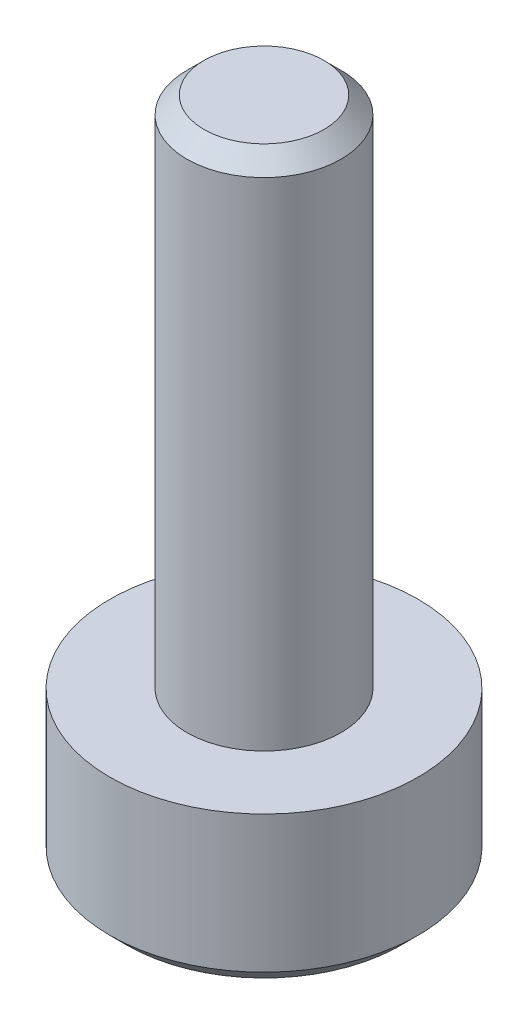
SolidWorks part; units mm, degrees
ref_plane "Front Plane" through (0, 0, 0) normal (0, 0, 1) x (1, 0, 0)
ref_plane "Top Plane" through (0, 0, 0) normal (0, 1, 0) x (1, 0, 0)
ref_plane "Right Plane" through (0, 0, 0) normal (1, 0, 0) x (0, 0, -1)
sketch "Sketch1" plane through (0, 0, 0) normal (0, 1, 0) x (1, 0, 0)
  circle A0 centre (0, 0) radius 1.5
  dimension "D1" = 3
extrude "Boss-Extrude1" add sketch "Sketch1" along normal blind 10
sketch "Sketch2" plane through (0, 0, 0) normal (0, -1, 0) x (1, 0, 0)
  circle A0 centre (0, 0) radius 3
  circle A1 centre (0, 0) radius 1.5 construction
extrude "Boss-Extrude2" add sketch "Sketch2" along normal blind 3 contours A0
sketch "Sketch3" plane through (0, -3, 0) normal (0, -1, 0) x (1, 0, 0)
  line L1 (0, 1.7321) -> (-1.5, 0.866)
  line L2 (-1.5, 0.866) -> (-1.5, -0.866)
  line L3 (-1.5, -0.866) -> (0, -1.7321)
  line L4 (0, -1.7321) -> (1.5, -0.866)
  line L5 (1.5, -0.866) -> (1.5, 0.866)
  line L6 (1.5, 0.866) -> (0, 1.7321)
  circle A0 centre (0, 0) radius 1.5 construction
extrude "Cut-Extrude1" cut sketch "Sketch3" against normal blind 2
chamfer "Chamfer1" distance 0.3333 angle 45 2 edges at (0, 10, 1.5) (0, -3, -3)
equation "\"Length\"= 10"
equation "\"Dia\"= 3"
equation "\"D1@Sketch2\"=\"Dia\"/2"
equation "\"D1@Boss-Extrude2\"=\"Dia\""
equation "\"D1@Sketch3\"=\"Dia\""
equation "\"D1@Cut-Extrude1\"=\"Dia\"/1.5"
equation "\"D1@Chamfer1\"=\"Dia\"/(\"Dia\"*3)"
equation "\"D1@Boss-Extrude1\"=\"Length\""
